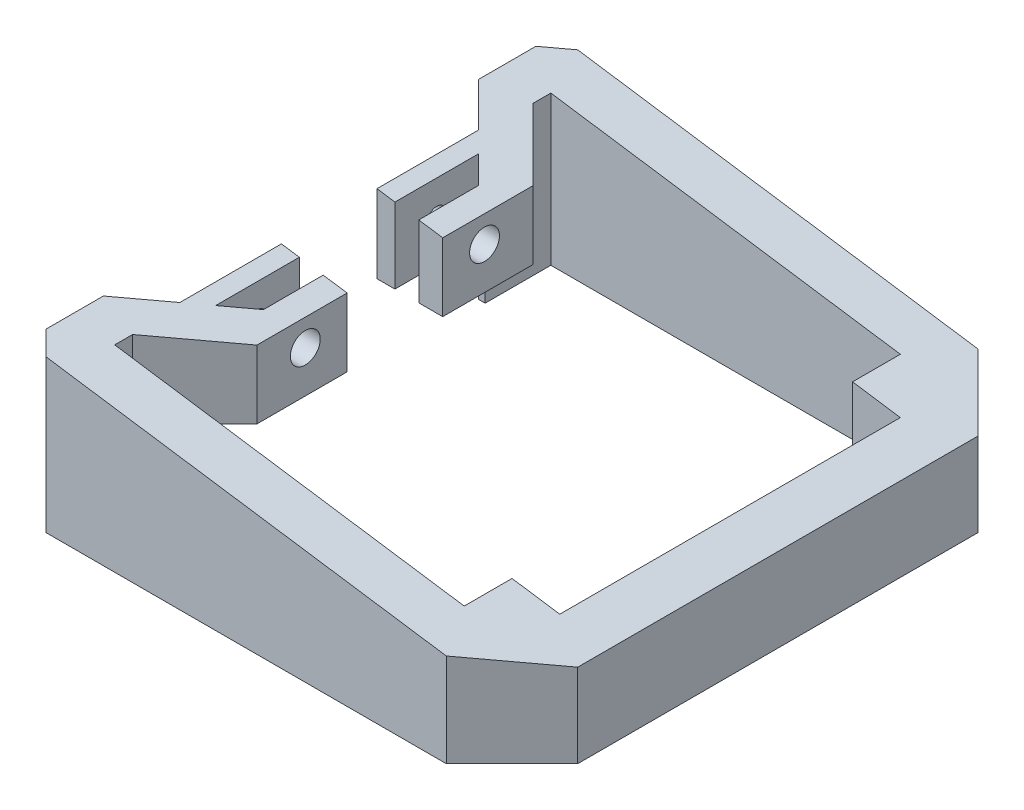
SolidWorks part; units mm, degrees
ref_plane "Front Plane" through (0, 0, 0) normal (0, 0, 1) x (1, 0, 0)
ref_plane "Top Plane" through (0, 0, 0) normal (0, 1, 0) x (1, 0, 0)
ref_plane "Right Plane" through (0, 0, 0) normal (1, 0, 0) x (0, 0, -1)
sketch "Sketch1" plane through (0, 0, 0) normal (0, 1, 0) x (1, 0, 0)
  line L0 (31, 1.5) -> (31, -2.5)
  line L1 (31, -2.5) -> (35, -2.5)
  line L2 (35, -2.5) -> (35, -31)
  line L3 (35, -31) -> (31, -31)
  line L4 (31, -31) -> (31, -35)
  line L5 (31, -35) -> (1.75, -35)
  line L6 (1.75, -35) -> (1.75, 1.5) construction
  line L7 (1.75, 1.5) -> (31, 1.5)
  line L8 (39, 0) -> (39, -33.5)
  line L9 (35, -16.75) -> (39, -16.75) construction
  line L10 (0, 5.5) -> (33.5, 5.5)
  line L11 (33.5, 5.5) -> (39, 0)
  line L12 (39, -33.5) -> (33.5, -39)
  line L13 (33.5, -39) -> (0, -39)
  line L14 (-3.25, -16.75) -> (1.75, -16.75) construction
  line L15 (0, -39) -> (-3.25, -35.75) construction
  line L16 (0, 5.5) -> (-3.25, 2.25) construction
  line L17 (-3.25, 2.25) -> (-3.25, -35.75) construction
  line L18 (4.95, 1.5) -> (4.95, -35) construction
  line L19 (-3.25, 2.25) -> (-3.25, -2.5) construction
  line L20 (-3.25, -2.5) -> (4.95, -10.7) construction
  line L21 (-3.25, -35.75) -> (-3.25, -31) construction
  line L22 (-3.25, -31) -> (4.95, -22.8) construction
  line L23 (4.95, -22.8) -> (4.95, -10.7)
  line L24 (1.75, 1.5) -> (1.75, 0)
  line L25 (1.75, -35) -> (1.75, -33.5)
  line L26 (6.95, 1.5) -> (6.95, -35) construction
  line L27 (1.75, 0) -> (6.95, -5.2)
  line L28 (1.75, -33.5) -> (6.95, -28.3)
  line L29 (6.95, -5.2) -> (6.95, -28.3)
  line L30 (2.95, -8.7) -> (2.95, -24.8)
  line L31 (1.45, -7.2) -> (1.45, -26.3)
  line L32 (-3.25, -2.5) -> (1.45, -7.2) construction
  line L33 (2.95, -8.7) -> (4.95, -10.7)
  line L34 (2.95, -24.8) -> (4.95, -22.8)
  line L35 (1.45, -26.3) -> (-3.25, -31) construction
  line L36 (-1.75, -29.5) -> (-1.75, -37.25)
  line L37 (-1.75, -29.5) -> (1.45, -26.3)
  line L38 (0, -39) -> (-1.75, -37.25)
  line L39 (-1.75, 3.75) -> (-1.75, -4)
  line L40 (-1.75, 3.75) -> (0, 5.5)
  line L41 (-1.75, -4) -> (1.45, -7.2)
  circle A0 centre (0, 0) radius 1.1
  circle A1 centre (33.5, 0) radius 1.1
  circle A2 centre (0, -33.5) radius 1.1
  circle A3 centre (33.5, -33.5) radius 1.1
  dimension "D1" = 2.2
  dimension "D2" = 33.5
  dimension "D3" = 33.5
  dimension "D4" = 2.5
  dimension "D6" = 2.5
  dimension "D9" = 1.75
  dimension "D14" = 5
  dimension "D5" = 2.5
  dimension "D7" = 4
  dimension "D8" = 4
  dimension "D10" = 4
  dimension "D11" = 4
  dimension "D12" = 4
  dimension "D13" = 225
  dimension "D15" = 8.2
  dimension "D16" = 135
  dimension "D17" = 10.2
  dimension "D18" = 2
  dimension "D19" = 1.5
  dimension "D20" = 1.75
extrude "Boss-Extrude1" add sketch "Sketch1" along normal blind 6
sketch "Sketch2" plane through (0, 6, 0) normal (0, 1, 0) x (1, 0, 0)
  line L0 (4.95, -16.75) -> (35, -16.75) construction
  line L1 (4.95, -10.7) -> (4.95, -22.8) construction
  line L2 (35, -31) -> (35, -2.5) construction
  line L3 (4.95, -7.75) -> (4.95, -25.75)
  line L4 (1.75, -33.5) -> (1.75, -35)
  line L5 (6.95, -28.3) -> (6.95, -5.2)
  line L6 (6.95, -5.2) -> (1.75, 0)
  line L7 (6.95, -5.2) -> (6.95, -28.3) construction
  line L8 (1.75, -35) -> (31, -35)
  line L9 (31, -35) -> (31, -31)
  line L10 (31, -31) -> (35, -31)
  line L11 (1.75, 0) -> (6.95, -5.2) construction
  line L12 (35, -31) -> (35, -2.5)
  line L14 (35, -2.5) -> (31, -2.5)
  line L15 (0, 5.5) -> (-1.75, 3.75)
  line L16 (-1.75, 3.75) -> (-1.75, -1.05)
  line L17 (-1.75, -1.05) -> (4.95, -7.75) construction
  line L18 (6.95, -28.3) -> (1.75, -33.5)
  line L19 (31, -2.5) -> (31, 1.5)
  line L21 (31, 1.5) -> (1.75, 1.5)
  line L22 (0, -39) -> (-1.75, -37.25)
  line L23 (-1.75, -37.25) -> (-1.75, -32.45)
  line L24 (-1.75, -32.45) -> (4.95, -25.75) construction
  line L25 (1.45, -4.25) -> (1.45, -29.25)
  line L26 (2.95, -5.75) -> (2.95, -27.75)
  line L27 (-1.75, -1.05) -> (1.45, -4.25)
  line L28 (2.95, -5.75) -> (4.95, -7.75)
  line L29 (2.95, -27.75) -> (4.95, -25.75)
  line L30 (1.45, -29.25) -> (-1.75, -32.45)
  line L31 (1.75, 1.5) -> (1.75, 0)
  line L32 (0, 5.5) -> (33.5, 5.5)
  line L33 (33.5, 5.5) -> (39, 0)
  line L34 (39, 0) -> (39, -33.5)
  line L35 (39, -33.5) -> (33.5, -39)
  line L36 (33.5, -39) -> (0, -39)
  line L37 (2.95, -8.7) -> (2.95, -24.8) construction
  point P8 (4.95, -16.75)
  dimension "D1" = 18
  dimension "D2" = 1.5
extrude "Boss-Extrude2" add sketch "Sketch2" along normal blind 7
sketch "Sketch4" plane through (6.95, 0, 0) normal (1, 0, 0) x (0, 0, -1)
  line L0 (-24.25, 9.5) -> (-9.25, 9.5) construction
  line L1 (-16.75, 13) -> (-16.75, 6) construction
  line L2 (-28.3, 13) -> (-5.2, 13) construction
  line L3 (-24.25, 9.5) -> (-23.7557, 9.5) construction
  line L4 (-9.25, 9.5) -> (-9.7443, 9.5) construction
  line L5 (-33.5, 6) -> (0, 6) construction
  circle A0 centre (-24.25, 9.5) radius 1.25
  circle A1 centre (-9.25, 9.5) radius 1.25
  point P12 (-16.75, 9.5)
  dimension "D1" = 2.5
  dimension "D2" = 15
extrude "Cut-Extrude1" cut sketch "Sketch4" against normal blind 2
sketch "Sketch7" plane through (4.95, 0, 0) normal (-1, 0, 0) x (0, 0, 1)
  line L0 (12.75, 13) -> (20.75, 13)
  line L3 (7.75, 13) -> (25.75, 13) construction
  line L4 (20.75, 13) -> (20.75, 0)
  line L5 (12.75, 13) -> (12.75, 0)
  line L6 (0, 4) -> (33.5, 4) construction
  line L7 (10.7, 0) -> (22.8, 0) construction
  line L8 (16.75, 4) -> (16.75, 0) construction
  line L9 (14.75, 4) -> (14.75, 0) construction
  line L10 (18.75, 4) -> (18.75, 0) construction
  line L11 (14.75, 2) -> (18.75, 2) construction
  line L12 (33.5, 13) -> (33.5, 0) construction
  line L15 (12.75, 0) -> (20.75, 0)
  point P21 (16.75, 2)
  dimension "D2" = 4
  dimension "D3" = 4
  dimension "D4" = 8
extrude "Cut-Extrude3" cut sketch "Sketch7" against normal up to next and the other way blind 6
sketch "Sketch8" plane through (2.95, 0, 0) normal (1, 0, 0) x (0, 0, -1)
  circle A0 centre (-24.25, 9.5) radius 0.75
  circle A1 centre (-9.25, 9.5) radius 0.75
  dimension "D1" = 1.5
extrude "Cut-Extrude4" cut sketch "Sketch8" against normal blind 2
sketch "Sketch9" plane through (0, 0, 39) normal (0, 0, 1) x (1, 0, 0)
  line L0 (-1.75, 4) -> (39, 4) construction
  line L1 (39, 13) -> (39, 0) construction
  line L2 (-1.75, 13) -> (39, 7)
  line L3 (39, 7) -> (39, 13)
  line L4 (39, 13) -> (-1.75, 13)
  line L5 (-1.75, 13) -> (-1.75, 0) construction
  dimension "D1" = 6
extrude "Cut-Extrude5" cut sketch "Sketch9" against normal through all
sketch "Sketch10" plane through (0, 0, 0) normal (0, -1, 0) x (1, 0, 0)
  line L0 (-1.75, 29.5) -> (1.75, 29.5) construction
  line L1 (-1.75, 32.45) -> (-1.75, 29.5)
  line L2 (1.75, 29.5) -> (1.75, 33.5)
  line L3 (1.75, 33.5) -> (6.95, 28.3)
  line L4 (6.95, 28.3) -> (6.95, 5.2)
  line L5 (-1.75, 32.45) -> (1.2, 29.5)
  line L6 (6.95, 5.2) -> (1.75, 0)
  line L7 (1.75, 0) -> (1.75, 4)
  line L8 (1.75, 4) -> (-1.75, 4) construction
  line L9 (-1.75, 32.45) -> (1.45, 29.25) construction
  line L10 (-1.75, 4) -> (1.45, 7.2)
  line L11 (1.45, 7.2) -> (1.45, 26.3)
  line L12 (1.45, 26.3) -> (-1.75, 29.5)
  line L13 (1.2, 29.5) -> (1.75, 29.5)
  line L14 (-1.75, 4) -> (-1.75, 1.05)
  line L15 (-1.75, 1.05) -> (1.2, 4)
  line L16 (1.2, 4) -> (1.75, 4)
extrude "Cut-Extrude6" cut sketch "Sketch10" against normal up to surface (6 mm away)
